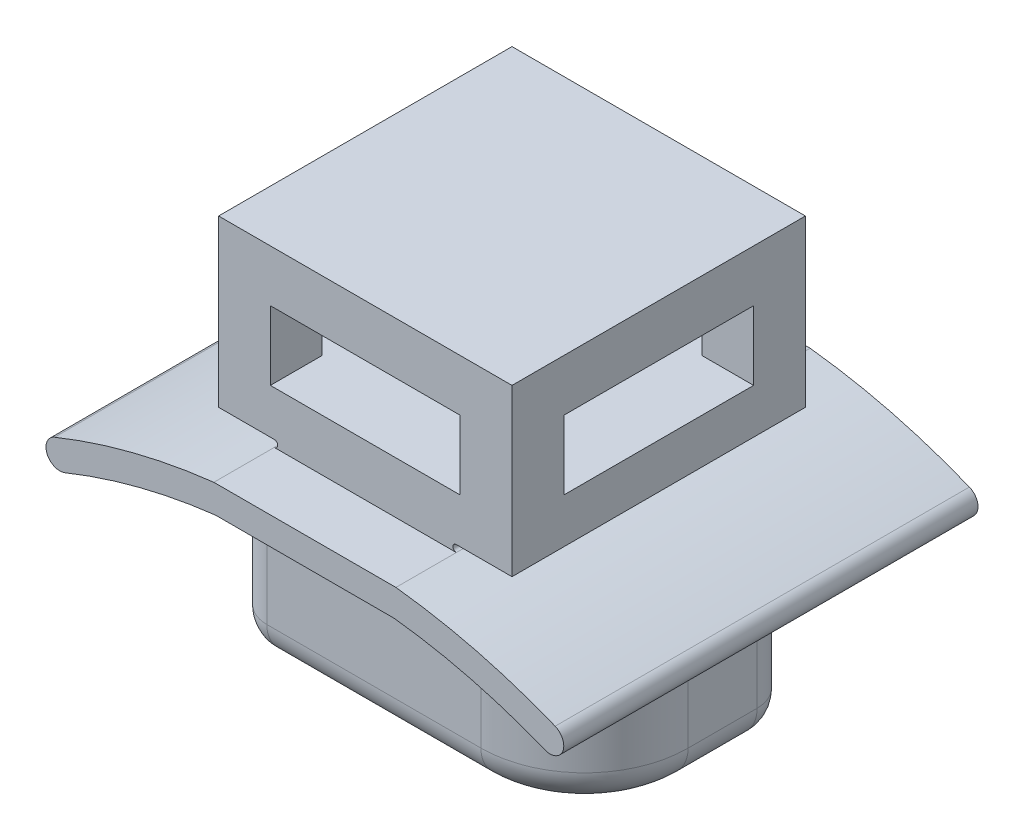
SolidWorks part; units mm, degrees
ref_plane "正面" through (0, 0, 0) normal (0, 0, 1) x (1, 0, 0)
ref_plane "平面" through (0, 0, 0) normal (0, 1, 0) x (1, 0, 0)
ref_plane "右側面" through (0, 0, 0) normal (1, 0, 0) x (0, 0, -1)
sketch "ｽｹｯﾁ1" plane through (0, 0, 0) normal (0, 0, 1) x (1, 0, 0)
  line L0 (-2.6373, -5) -> (2.6373, -5)
  line L9 (-4.25, -4.8) -> (-4.25, 0)
  line L10 (4.25, 0) -> (4.25, -4.8)
  line L11 (4.25, -4.8) -> (2.6373, -4.8)
  line L12 (-2.6373, -4.8) -> (-4.25, -4.8)
  line L13 (-4.25, 0) -> (4.25, 0)
  line L14 (2.75, -3.5) -> (2.75, -1.5)
  line L15 (-2.75, -1.5) -> (-2.75, -3.5)
  line L16 (2.75, -1.5) -> (-2.75, -1.5)
  line L17 (-2.75, -3.5) -> (2.75, -3.5)
  arc A0 (2.6373, -4.8) -> (2.6373, -5) centre (2.6373, -4.9) ccw
  arc A1 (-2.6373, -5) -> (-2.6373, -4.8) centre (-2.6373, -4.9) ccw
  dimension "D1" = 8.5
  dimension "D2" = 1.5
  dimension "D3" = 2
  dimension "D4" = 1.3
extrude "押し出し1" add sketch "ｽｹｯﾁ1" along normal mid plane 8.5
sketch "ｽｹｯﾁ4" plane through (4.25, 0, 0) normal (1, 0, 0) x (0, 0, -1)
  line L0 (-4.25, -4.8) -> (-4.25, 0) construction
  line L1 (-4.25, 0) -> (4.25, 0) construction
  line L2 (4.25, -4.8) -> (4.25, 0) construction
  line L7 (-2.75, -3.5) -> (2.75, -3.5)
  line L8 (2.75, -1.5) -> (-2.75, -1.5)
  line L9 (2.75, -3.5) -> (2.75, -1.5)
  line L10 (-2.75, -1.5) -> (-2.75, -3.5)
  dimension "D1" = 1.5
  dimension "D2" = 1.5
  dimension "D3" = 1.5
extrude "押し出し3" cut sketch "ｽｹｯﾁ4" against normal through all
sketch "ｽｹｯﾁ5" plane through (0, 0, 0) normal (0, 0, 1) x (1, 0, 0)
  line L0 (2.6373, -4.8) -> (4.25, -4.8) construction
  line L1 (-4.25, -4.8) -> (-2.6373, -4.8) construction
  line L3 (-2.5, -5.8) -> (2.5, -5.8)
  line L4 (-2.5, -6.8) -> (-2.5, -5.8)
  line L5 (2.5, -6.8) -> (2.5, -5.8)
  line L19 (-4.1013, -11.8) -> (4.1013, -11.8)
  line L20 (-3, -8.8) -> (-5.1013, -8.8)
  line L21 (-5.1013, -8.8) -> (-5.1013, -10.8)
  line L22 (5.1013, -8.8) -> (3, -8.8)
  line L26 (3, -6.8) -> (2.5, -6.8)
  line L27 (3, -8.8) -> (3, -6.8)
  line L28 (-3, -8.8) -> (-3, -6.8)
  line L29 (-2.5, -6.8) -> (-3, -6.8)
  line L30 (5.1013, -8.8) -> (5.1013, -10.8)
  arc A0 (-4.1013, -11.8) -> (-5.1013, -10.8) centre (-4.1013, -10.8) cw
  arc A1 (5.1013, -10.8) -> (4.1013, -11.8) centre (4.1013, -10.8) cw
  dimension "D8" = 1
  dimension "D2" = 2
  dimension "D3" = 2
  dimension "D4" = 3
  dimension "D5" = 2
  dimension "D6" = 2
  dimension "D7" = 3
  dimension "D10" = 6
extrude "押し出し4" add sketch "ｽｹｯﾁ5" along normal mid plane 6
sketch "ｽｹｯﾁ2" plane through (0, 0, 0) normal (0, 0, 1) x (1, 0, 0)
  line L1 (2.5913, -5.8) -> (-2.5913, -5.8)
  line L2 (-2.6373, -5) -> (2.6373, -5)
  arc A0 (-7.2504, -6.1753) -> (-6.9496, -6.9166) centre (-7.1, -6.5459) ccw
  arc A1 (2.5913, -5.8) -> (6.9496, -6.9166) centre (0.6464, -22.4554) cw
  arc A2 (2.6373, -5) -> (7.2504, -6.1753) centre (0.6464, -22.4554) cw
  arc A3 (7.2504, -6.1753) -> (6.9496, -6.9166) centre (7.1, -6.5459) cw
  arc A8 (-2.6373, -5) -> (-7.2504, -6.1753) centre (-0.6464, -22.4554) ccw
  arc A9 (-2.5913, -5.8) -> (-6.9496, -6.9166) centre (-0.6464, -22.4554) ccw
  point P14 (0, 0.001)
  point P15 (0.001, 0.001)
  point P16 (0.001, 0)
extrude "押し出し2" add sketch "ｽｹｯﾁ2" along normal mid plane 12
fillet "ﾌｨﾚｯﾄ3" radius 3 2 edges at (3, -7.8, 3) (-3, -7.8, -3)
fillet "ﾌｨﾚｯﾄ6" radius 3 2 edges at (5.1013, -9.8, 3) (-5.1013, -9.8, -3)
fillet "ﾌｨﾚｯﾄ5" radius 1 8 edges at (5.1013, -9.8, -3) (-5.1013, -9.8, 3) (1, -11.8, -3) (-1, -11.8, 3) (-3.1718, -11.8, -2.8025) (3.1718, -11.8, 2.8025) (4.8084, -11.5071, -3) (-4.8084, -11.5071, 3)
